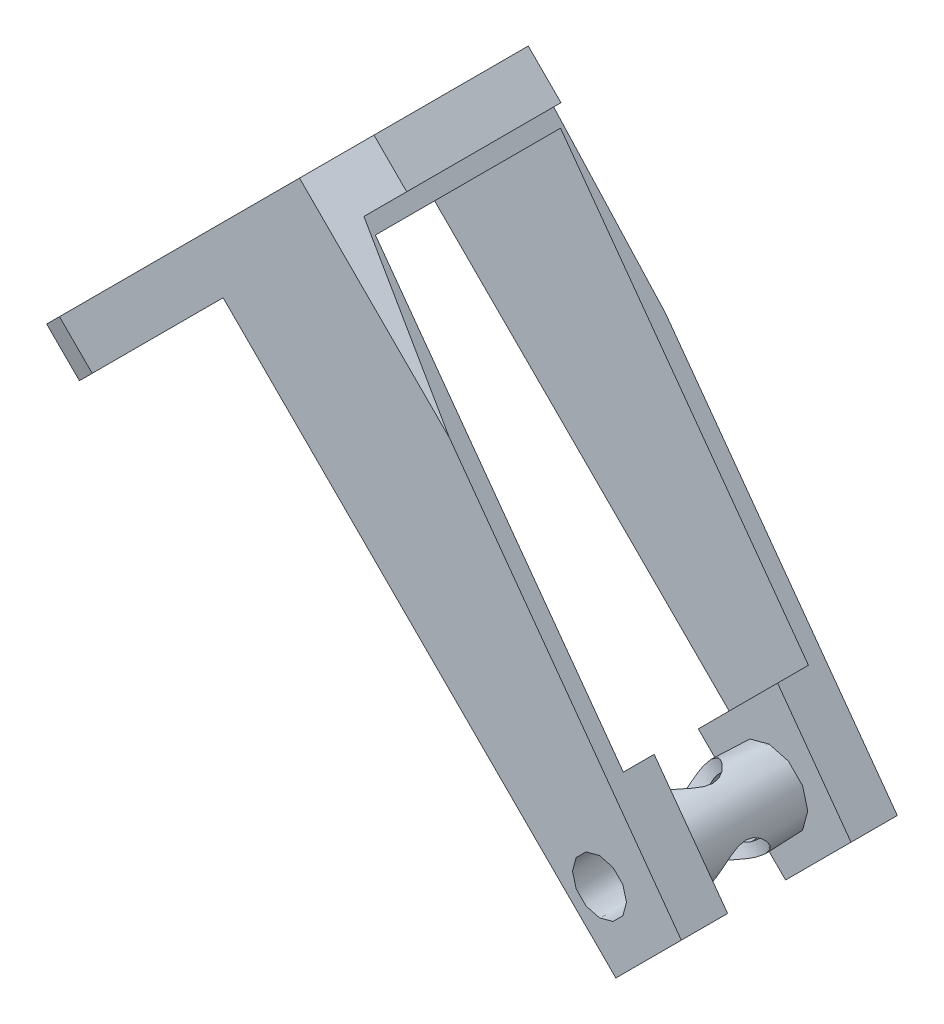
SolidWorks part; units mm, degrees
ref_plane "Plan de face" through (0, 0, 0) normal (0, 0, 1) x (1, 0, 0)
ref_plane "Plan de dessus" through (0, 0, 0) normal (0, 1, 0) x (1, 0, 0)
ref_plane "Plan de droite" through (0, 0, 0) normal (1, 0, 0) x (0, 0, -1)
sketch "Esquisse24" plane through (0, 0, 0) normal (0, 0, 1) x (1, 0, 0)
  line L1 (53.033, -3.5355) -> (10.6066, -45.9619)
  line L3 (-378.3021, 116.6726) -> (-166.1701, 328.8047)
  line L4 (-161.2073, 291.341) -> (-144.9569, 307.5914)
  line L5 (-144.9569, 307.5914) -> (-166.1701, 328.8047)
  line L6 (-378.3021, 116.6726) -> (-357.0889, 95.4594)
  line L7 (0, 0) -> (151.4442, 0) construction
  line L8 (53.033, -3.5355) -> (-161.2073, 291.341)
  line L9 (10.6066, -45.9619) -> (-243.9518, 208.5965)
  line L10 (-357.0889, 95.4594) -> (-243.9518, 208.5965)
  circle A0 centre (0, 0) radius 17.5
  dimension "D10" = 35
  dimension "D1" = 60
  dimension "D2" = 300
  dimension "D3" = 30
  dimension "D4" = 115
  dimension "D5" = 25
  dimension "D6" = 40
  dimension "D7" = 45
  dimension "D8" = 9
  dimension "D9" = 350
extrude "Boss.-Extru.1" add sketch "Esquisse24" along normal mid plane 140
sketch "Esquisse25" plane through (-17.6777, -17.6777, 0) normal (0.7071, 0.7071, 0) x (0, 0, -1)
  line L1 (-60, 310) -> (60, 310)
  line L2 (-60, 310) -> (-60, 40)
  line L3 (-40, 27.9772) -> (40, 27.9772)
  line L4 (60, 310) -> (60, 40)
  line L5 (-60, 310) -> (-14.589, -206.006) construction
  line L6 (-60, -168.5875) -> (60, 310) construction
  line L10 (-60, 40) -> (-40, 40)
  line L11 (-40, 40) -> (-40, 27.9772)
  line L12 (0, 70.7062) -> (0, -13.283) construction
  line L13 (60, 40) -> (40, 40)
  line L14 (40, 40) -> (40, 27.9772)
  line L15 (-70, -40) -> (70, -40) construction
  line L16 (70, 320) -> (70, -40) construction
  point P0 (-28.8242, -44.2512)
  dimension "D1" = 310
  dimension "D2" = 80
  dimension "D4" = 80
  dimension "D5" = 10
extrude "Enlèv. mat.-Extru.6" cut sketch "Esquisse25" along normal through all
sketch "Esquisse26" plane through (-247.4874, 247.4874, 0) normal (0.7071, -0.7071, 0) x (0, 0, -1)
  circle A0 centre (0, 0) radius 20
  dimension "D1" = 40
extrude "Enlèv. mat.-Extru.7" cut sketch "Esquisse26" along normal through all contours A0
sketch "Esquisse27" plane through (-247.4874, 247.4874, 0) normal (-0.7071, 0.7071, 0) x (0, 0, 1)
  line L0 (0, -185) -> (0, 115) construction
  line L3 (70, -185) -> (-70, -185) construction
  line L4 (80, 55) -> (45, 125)
  line L5 (45, 125) -> (80, 125)
  line L6 (80, 125) -> (80, 55)
  line L7 (70, 115) -> (-70, 115) construction
  line L8 (70, 115) -> (70, -185) construction
  line L9 (0, -35) -> (111.4466, -35) construction
  line L10 (80, -195) -> (80, -125)
  line L11 (45, -195) -> (80, -195)
  line L12 (80, -125) -> (45, -195)
  line L13 (-80, -125) -> (-45, -195)
  line L14 (-45, -195) -> (-80, -195)
  line L15 (-80, -195) -> (-80, -125)
  line L16 (-80, 125) -> (-80, 55)
  line L17 (-45, 125) -> (-80, 125)
  line L18 (-80, 55) -> (-45, 125)
  dimension "D1" = 10
  dimension "D2" = 10
  dimension "D3" = 45
  dimension "D4" = 60
extrude "Enlèv. mat.-Extru.8" cut sketch "Esquisse27" against normal through all
sketch "Esquisse28" plane through (0, 0, 40) normal (0, 0, -1) x (-1, 0, 0)
  circle A0 centre (0, 0) radius 25
  circle A1 centre (0, 0) radius 100
  circle A2 centre (0, 0) radius 17.5 construction
  dimension "D1" = 50
  dimension "D2" = 200
extrude "Enlèv. mat.-Extru.9" cut sketch "Esquisse28" along normal up to surface (80 mm away)
